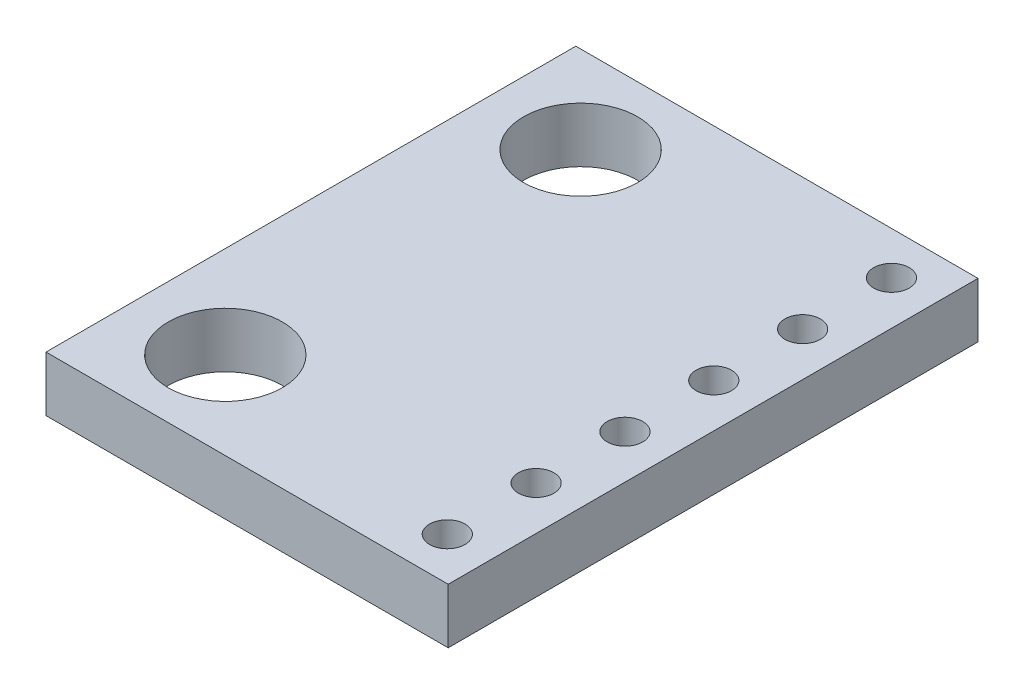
SolidWorks part; units mm, degrees
ref_plane "Front Plane" through (0, 0, 0) normal (0, 0, 1) x (1, 0, 0)
ref_plane "Top Plane" through (0, 0, 0) normal (0, 1, 0) x (1, 0, 0)
ref_plane "Right Plane" through (0, 0, 0) normal (1, 0, 0) x (0, 0, -1)
sketch "Sketch1" plane through (0, 0, 0) normal (0, 1, 0) x (1, 0, 0)
  line L0 (2.632, 12.655) -> (2.632, 15.15) construction
  line L1 (0, 0) -> (11.5, 0)
  line L2 (0, 0) -> (0, 15.15)
  line L3 (0, 15.15) -> (11.5, 15.15)
  line L4 (11.5, 0) -> (11.5, 15.15)
  line L5 (2.632, 2.495) -> (2.632, 0) construction
  line L6 (1, 12.655) -> (0, 12.655) construction
  line L7 (10.25, 0.717) -> (10.25, 0) construction
  line L8 (10.25, 14.433) -> (10.25, 15.15) construction
  circle A0 centre (2.632, 12.655) radius 1.632
  circle A1 centre (2.632, 2.495) radius 1.632
  circle A2 centre (10.25, 13.925) radius 0.508
  circle A3 centre (10.25, 11.385) radius 0.508
  circle A4 centre (10.25, 8.845) radius 0.508
  circle A5 centre (10.25, 6.305) radius 0.508
  circle A7 centre (10.25, 3.765) radius 0.508
  circle A8 centre (10.25, 1.225) radius 0.508
  dimension "D4" = 3.2639
  dimension "D5" = 1
  dimension "D12" = 1.016
  dimension "D1" = 15.15
  dimension "D2" = 11.5
  dimension "D3" = 10.16
  dimension "D6" = 2.54
  dimension "D7" = 2.54
  dimension "D8" = 2.54
  dimension "D9" = 2.54
  dimension "D10" = 2.54
  dimension "D11" = 1.25
extrude "Boss-Extrude1" add sketch "Sketch1" along normal blind 1.5748
